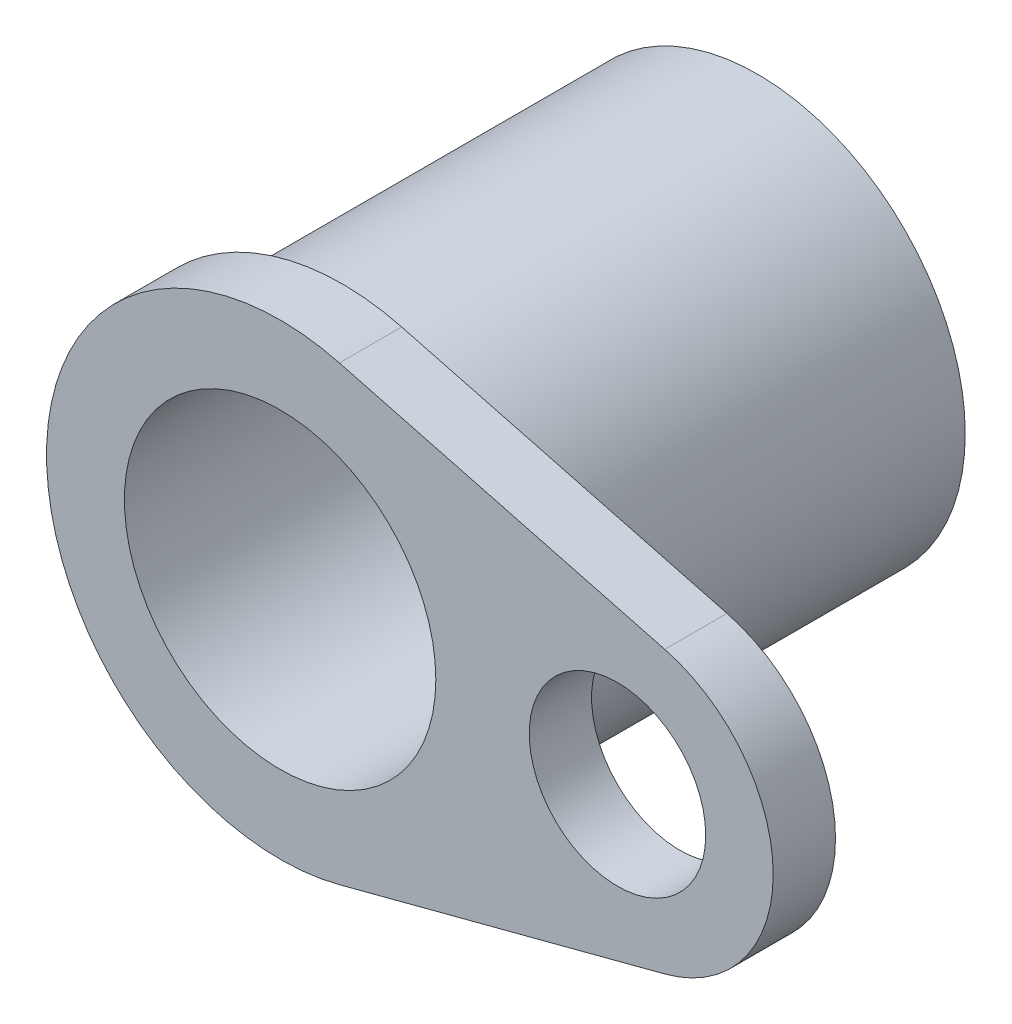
SolidWorks part; units mm, degrees
ref_plane "前视基准面" through (0, 0, 0) normal (0, 0, 1) x (1, 0, 0)
ref_plane "上视基准面" through (0, 0, 0) normal (0, 1, 0) x (1, 0, 0)
ref_plane "右视基准面" through (0, 0, 0) normal (1, 0, 0) x (0, 0, -1)
sketch "草图1" plane through (0, 0, 0) normal (0, 0, 1) x (1, 0, 0)
  circle A0 centre (0, 0) radius 4
  circle A1 centre (0, 0) radius 3
extrude "凸台-拉伸1" add sketch "草图1" along normal blind 8
sketch "草图2" plane through (0, 0, 8) normal (0, 0, 1) x (1, 0, 0)
  line L0 (-3.0097, 5.4418) -> (8.6532, 2.3824)
  line L1 (-4.5, 0) -> (3, 0)
  line L2 (8.2, 0) -> (9.5, 0)
  line L3 (-3.0097, -5.4418) -> (8.6532, -2.3824)
  line L4 (8.2, 0) -> (4.8, 0)
  circle A0 centre (0, 0) radius 3
  circle A1 centre (6.5, 0) radius 1.7
  arc A3 (1.1418, 4.3527) -> (1.1418, -4.3527) centre (0, 0) ccw
  arc A5 (7.4104, -2.7084) -> (7.4104, 2.7084) centre (6.7, 0) ccw
extrude "凸台-拉伸2" add sketch "草图2" along normal blind 1.2
